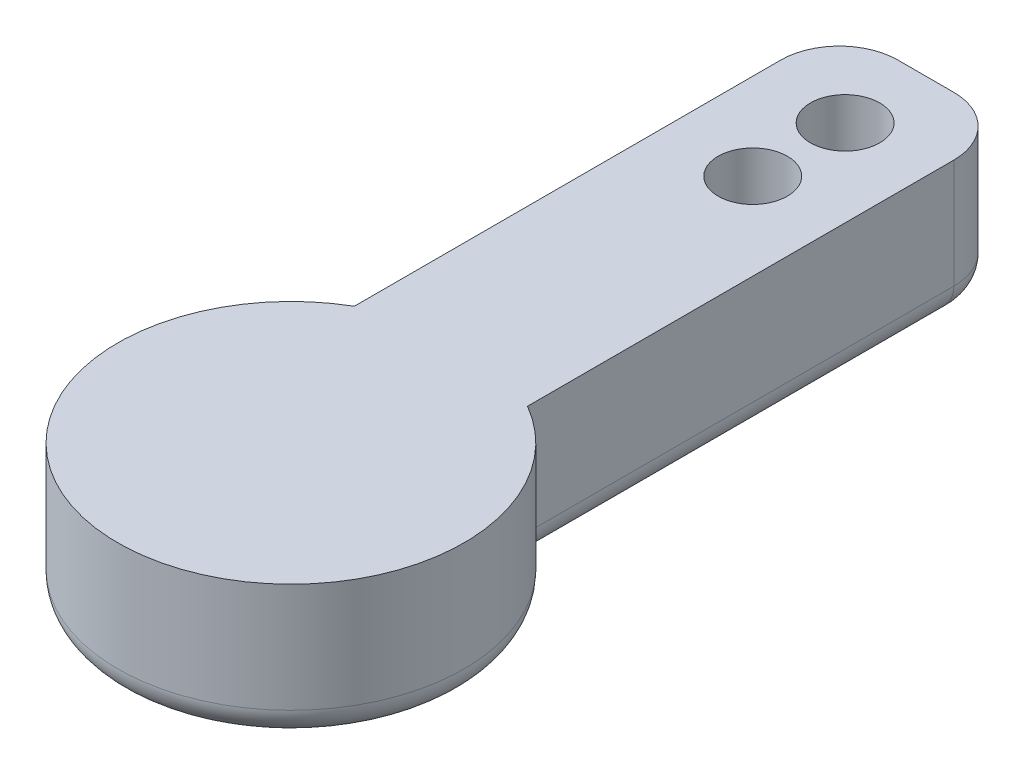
SolidWorks part; units mm, degrees
ref_plane "Front Plane" through (0, 0, 0) normal (0, 0, 1) x (1, 0, 0)
ref_plane "Top Plane" through (0, 0, 0) normal (0, 1, 0) x (1, 0, 0)
ref_plane "Right Plane" through (0, 0, 0) normal (1, 0, 0) x (0, 0, -1)
sketch "Sketch1" plane through (0, 0, 0) normal (0, 1, 0) x (1, 0, 0)
  line L0 (-3.75, 7.5) -> (-3.75, 6.4952)
  line L1 (-3.75, 27.5) -> (3.75, 27.5)
  line L2 (-3.75, 27.5) -> (-3.75, 7.5)
  line L3 (-3.75, 7.5) -> (3.75, 7.5)
  line L4 (3.75, 27.5) -> (3.75, 7.5)
  line L5 (-3.75, 27.5) -> (3.75, 7.5) construction
  line L6 (-3.75, 7.5) -> (3.75, 27.5) construction
  line L7 (3.75, 7.5) -> (3.75, 6.4952)
  circle A0 centre (0, 0) radius 7.5
  point P3 (0, 17.5)
  dimension "D1" = 15
  dimension "D2" = 20
  dimension "D3" = 7.5
extrude "Boss-Extrude1" add sketch "Sketch1" along normal blind 6 contours L4 L1 L2 L3 | A0 L7 L3 | A0 L3 L0 | A0
sketch "Sketch2" plane through (0, 0, 0) normal (0, -1, 0) x (1, 0, 0)
  circle A0 centre (0, 0) radius 3
  circle A1 centre (0, -20) radius 1.5
  circle A2 centre (0, -24) radius 1.5
  dimension "D1" = 6
  dimension "D2" = 3
  dimension "D3" = 3
  dimension "D4" = 4
  dimension "D5" = 20
extrude "Cut-Extrude1" cut sketch "Sketch2" against normal through all
sketch "Sketch3" plane through (0, 6, 0) normal (0, 1, 0) x (1, 0, 0)
  circle A0 centre (0, 0) radius 3
extrude "Boss-Extrude2" add sketch "Sketch3" against normal blind 1
fillet "Fillet1" radius 2.54 2 edges at (-3.75, 3, -27.5) (3.75, 3, -27.5)
fillet "Fillet4" radius 1.27 6 edges at (-3.0061, 0, -26.7561) (0, 0, -27.5) (3.0061, 0, -26.7561) (-3.75, 0, -15.7276) (3.75, 0, -15.7276) (0, 0, 7.5)
